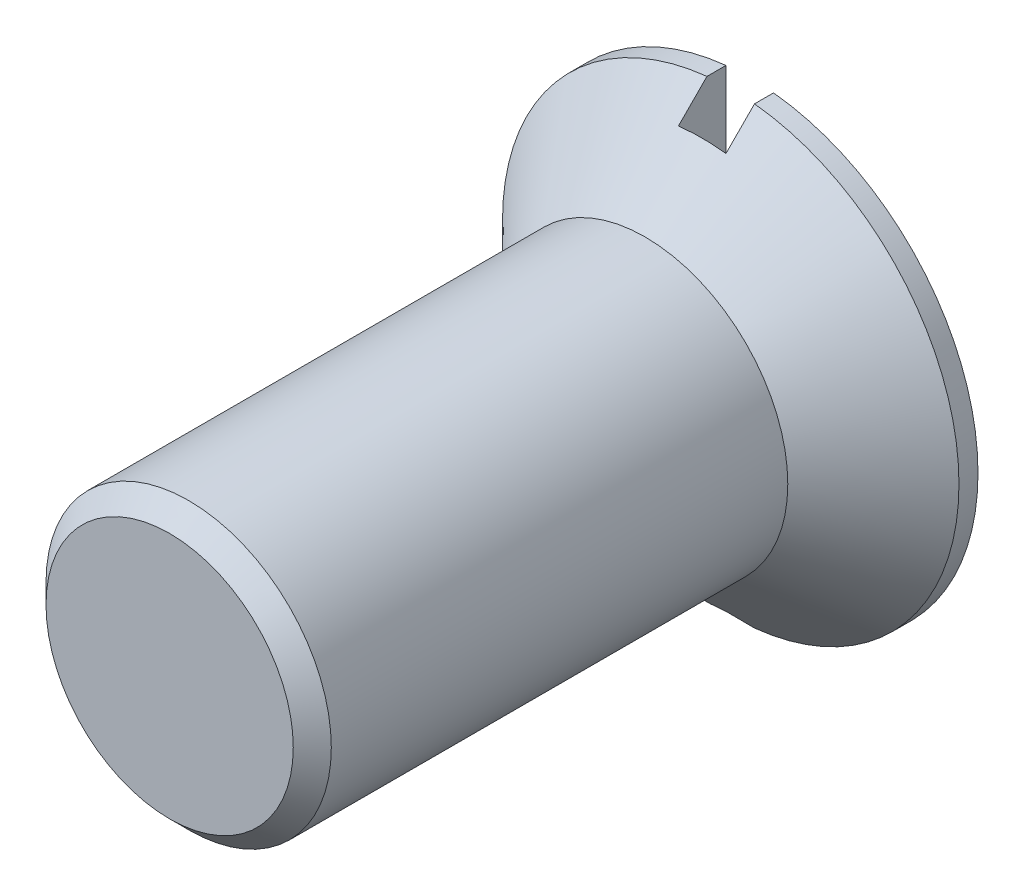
SolidWorks part; units mm, degrees
ref_plane "Front Plane" through (0, 0, 0) normal (0, 0, 1) x (1, 0, 0)
ref_plane "Top Plane" through (0, 0, 0) normal (0, 1, 0) x (1, 0, 0)
ref_plane "Right Plane" through (0, 0, 0) normal (1, 0, 0) x (0, 0, -1)
sketch "Sketch1" plane through (0, 0, 0) normal (0, 0, 1) x (1, 0, 0)
  circle A0 centre (0, 0) radius 1.5
  dimension "D1" = 3
extrude "Extrude1" add sketch "Sketch1" along normal blind 5
chamfer "Chamfer1" distance 0.2 angle 45 1 edges at (1.5, 0, 5)
sketch "Sketch3" plane through (0, 0, 0) normal (0, 1, 0) x (1, 0, 0)
  line L0 (-1.5, 0) -> (-2.4, 0.9)
  line L1 (-2.4, 0.9) -> (-2.4, 1.1)
  line L2 (-2.4, 1.1) -> (0, 1.1)
  line L3 (0, 1.1) -> (0, 0)
  line L4 (0, 0) -> (-1.5, 0)
  line L5 (0, 0) -> (0, 3.6806) construction
  dimension "D1" = 4.8
  dimension "D2" = 45
  dimension "D3" = 0.2
revolve "Revolve1" add sketch "Sketch3" angle 360 about L5
sketch "Sketch4" plane through (0, 0, -1.1) normal (0, 0, -1) x (-1, 0, 0)
  line L1 (-0.25, 3.1002) -> (0.25, 3.1002)
  line L2 (-0.25, 3.1002) -> (-0.25, -3.1002)
  line L3 (-0.25, -3.1002) -> (0.25, -3.1002)
  line L4 (0.25, 3.1002) -> (0.25, -3.1002)
  line L5 (-0.25, 3.1002) -> (0.25, -3.1002) construction
  line L6 (-0.25, -3.1002) -> (0.25, 3.1002) construction
  point P0 (0, 0)
  dimension "D1" = 0.5
extrude "Extrude2" cut sketch "Sketch4" against normal blind 0.5
